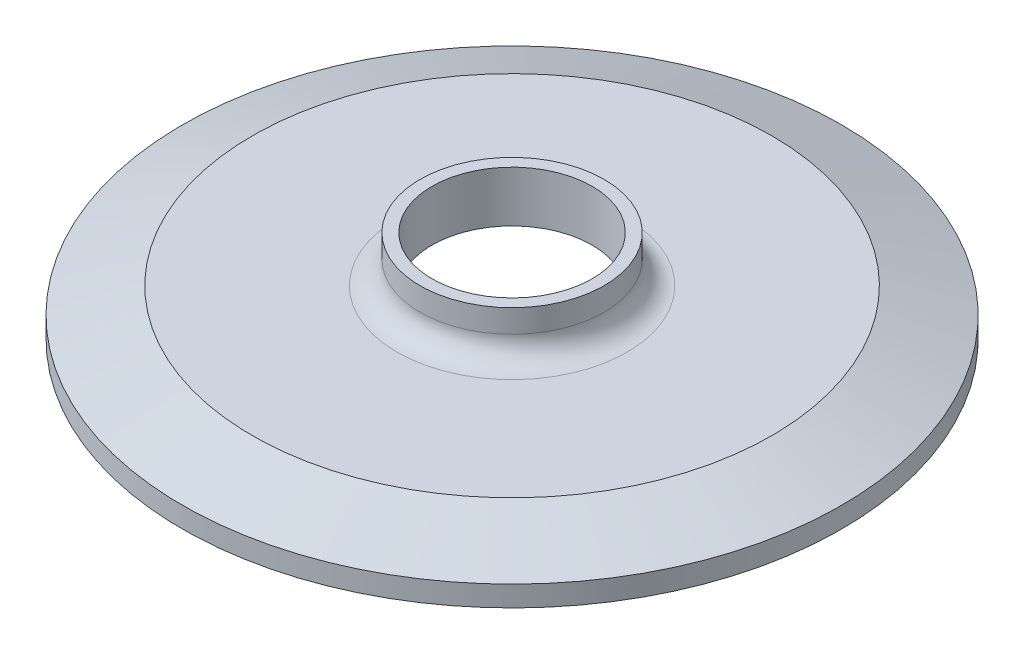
SolidWorks part; units mm, degrees
ref_plane "Front Plane" through (0, 0, 0) normal (0, 0, 1) x (1, 0, 0)
ref_plane "Top Plane" through (0, 0, 0) normal (0, 1, 0) x (1, 0, 0)
ref_plane "Right Plane" through (0, 0, 0) normal (1, 0, 0) x (0, 0, -1)
sketch "Sketch1" plane through (0, 0, 0) normal (0, 0, 1) x (1, 0, 0)
  line L0 (0, 0) -> (0, 8.8532) construction
  line L1 (-12.7, 12.7) -> (-12.7, 9.525)
  line L2 (-15.875, 6.35) -> (-35.8228, 6.35)
  line L3 (-35.8228, 6.35) -> (-45.4533, 2.8448)
  line L4 (-45.4533, 2.8448) -> (-45.4533, 0)
  line L5 (-45.4533, 0) -> (-43.6593, 0.0025)
  line L6 (-36.449, 0) -> (-39.6781, 0.0025)
  line L10 (-36.449, 0) -> (-11.049, 5.6776)
  line L11 (-11.049, 5.6776) -> (-11.049, 12.7)
  line L12 (-11.049, 12.7) -> (-12.7, 12.7)
  line L15 (-42.7676, 0.8754) -> (-42.9345, 0.4823)
  line L17 (-40.5698, 0.8754) -> (-40.4029, 0.4823)
  arc A0 (-15.875, 6.35) -> (-12.7, 9.525) centre (-15.875, 9.525) ccw
  arc A1 (-42.9345, 0.4823) -> (-43.6593, 0.0025) centre (-43.6593, 0.7899) cw
  arc A2 (-39.6781, 0.0025) -> (-40.4029, 0.4823) centre (-39.6781, 0.7899) cw
  arc A3 (-40.5698, 0.8754) -> (-42.7676, 0.8754) centre (-41.6687, 0.4089) ccw
  dimension "D3" = 3.175
  dimension "D7" = 0.7874
  dimension "D8" = 41.6687
  dimension "D9" = 0.7874
  dimension "D2" = 11.049
  dimension "D4" = 12.7
  dimension "D5" = 6.35
  dimension "D6" = 45.4533
  dimension "D10" = 20
  dimension "D11" = 36.449
  dimension "D12" = 12.7
  dimension "D13" = 2.8448
  dimension "D14" = 77.4
revolve "Revolve1" add sketch "Sketch1" angle 360 about L0
